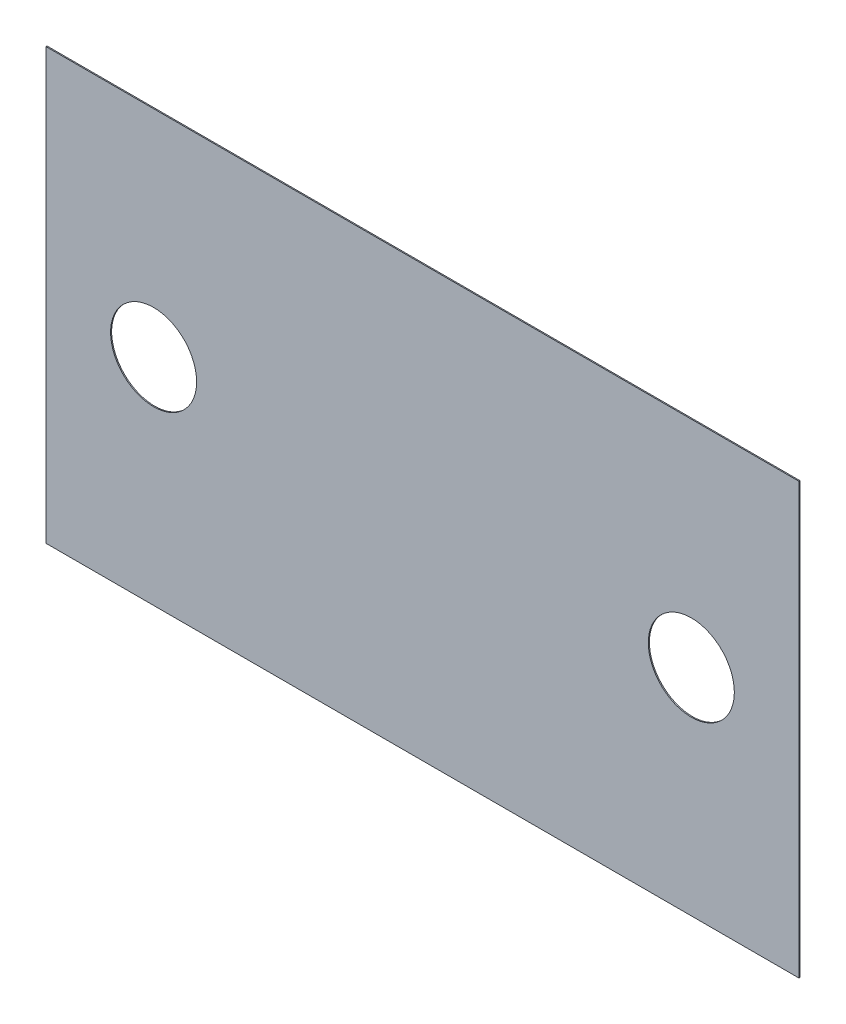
SolidWorks part; units mm, degrees
ref_plane "Alzado" through (0, 0, 0) normal (0, 0, 1) x (1, 0, 0)
ref_plane "Planta" through (0, 0, 0) normal (0, 1, 0) x (1, 0, 0)
ref_plane "Vista lateral" through (0, 0, 0) normal (1, 0, 0) x (0, 0, -1)
sketch "Croquis1" plane through (0, 0, 0) normal (0, 0, 1) x (1, 0, 0)
  line L1 (-35, 20) -> (35, 20)
  line L2 (-35, 20) -> (-35, -20)
  line L3 (-35, -20) -> (35, -20)
  line L4 (35, 20) -> (35, -20)
  circle A1 centre (-25, 0) radius 4
  circle A2 centre (25, 0) radius 4
extrude "Extruir1" add sketch "Croquis1" along normal blind 0.1
